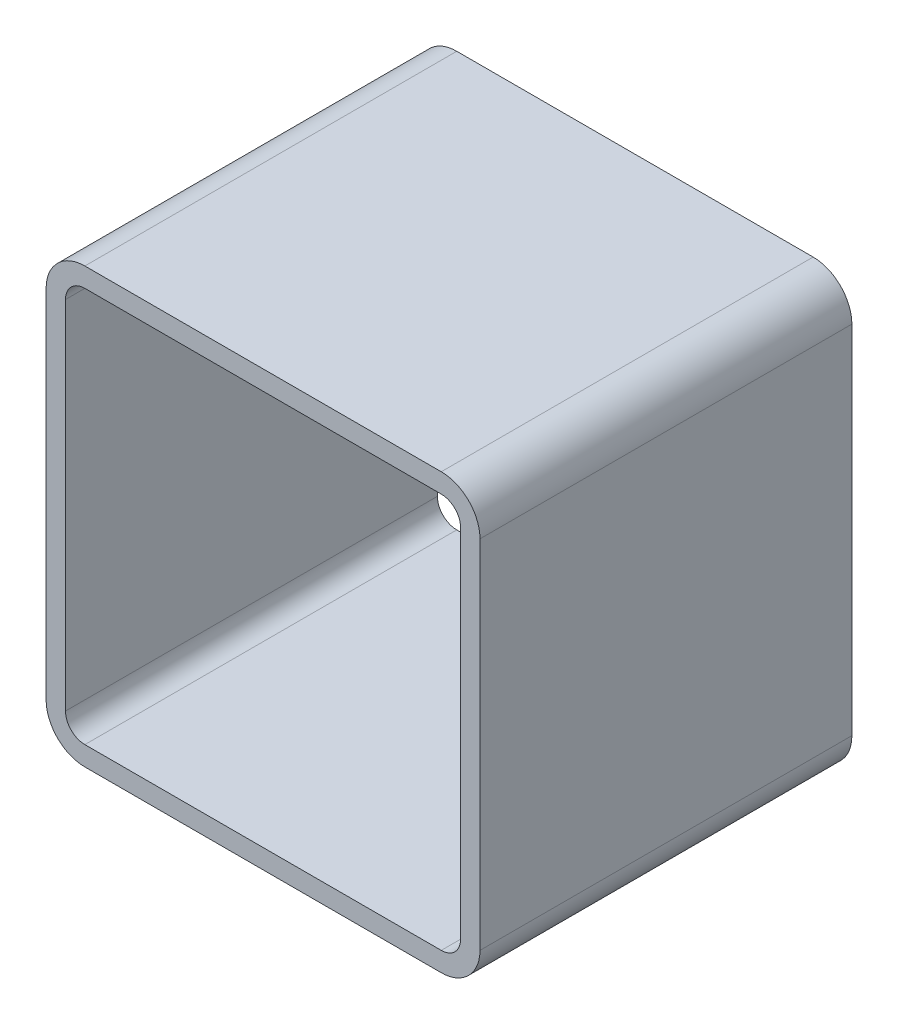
SolidWorks part; units mm, degrees
ref_plane "Front Plane" through (0, 0, 0) normal (0, 0, 1) x (1, 0, 0)
ref_plane "Top Plane" through (0, 0, 0) normal (0, 1, 0) x (1, 0, 0)
ref_plane "Right Plane" through (0, 0, 0) normal (1, 0, 0) x (0, 0, -1)
sketch "Sketch1" plane through (0, 0, 0) normal (0, 0, 1) x (1, 0, 0)
sketch_block_instance "HSS14x14x0.625-1"
sketch_block "HSS14x14x0.625"
extrude "Boss-Extrude1" add sketch "Sketch1" along normal blind 304.8
